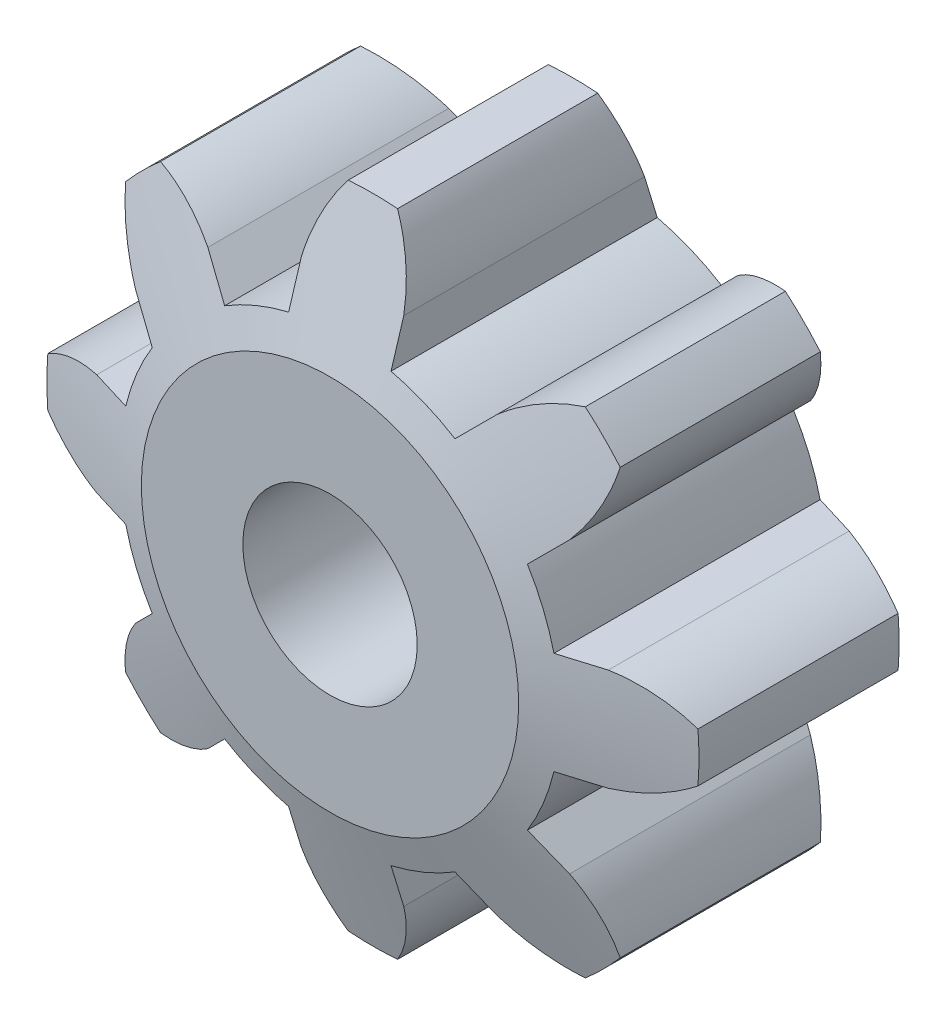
SolidWorks part; units mm, degrees
ref_plane "Front Plane" through (0, 0, 0) normal (0, 0, 1) x (1, 0, 0)
ref_plane "Top Plane" through (0, 0, 0) normal (0, 1, 0) x (1, 0, 0)
ref_plane "Right Plane" through (0, 0, 0) normal (1, 0, 0) x (0, 0, -1)
sketch "Sketch1" plane through (0, 0, 0) normal (1, 0, 0) x (0, 0, -1)
  line L0 (-5, 0) -> (5, 0)
  line L1 (3.5, 11.405) -> (-3.5, 11.405)
  line L14 (-5, 0) -> (-5, 6.6)
  line L15 (-5, 6.6) -> (-3.5, 11.405)
  line L16 (3.5, 11.405) -> (5, 6.6)
  line L17 (5, 6.6) -> (5, 0)
  dimension "D1" = 10
  dimension "D2" = 5
  dimension "D3" = 7
  dimension "D4" = 11.405
  dimension "D7" = 6.6
revolve "Revolve1" add sketch "Sketch1" angle 360 about L0
sketch "Sketch2" plane through (0, 0, 5) normal (0, 0, 1) x (1, 0, 0)
  line L0 (0, 0) -> (0, 11.405) construction
  line L3 (4.029, 6.5618) -> (5.0605, 7.5932)
  line L4 (-1.7909, 7.4888) -> (-1.7909, 8.9475)
  line L5 (1.7909, 8.9475) -> (1.7909, 7.4888)
  line L6 (7.5932, 5.0605) -> (6.5618, 4.029)
  line L8 (7.4888, 1.7909) -> (8.9475, 1.7909)
  line L9 (8.9475, -1.7909) -> (7.4888, -1.7909)
  line L11 (6.5618, -4.029) -> (7.5932, -5.0605)
  line L12 (5.0605, -7.5932) -> (4.029, -6.5618)
  line L14 (1.7909, -7.4888) -> (1.7909, -8.9475)
  line L15 (-1.7909, -8.9475) -> (-1.7909, -7.4888)
  line L17 (-4.029, -6.5618) -> (-5.0605, -7.5932)
  line L18 (-7.5932, -5.0605) -> (-6.5618, -4.029)
  line L20 (-7.4888, -1.7909) -> (-8.9475, -1.7909)
  line L21 (-8.9475, 1.7909) -> (-7.4888, 1.7909)
  line L23 (-6.5618, 4.029) -> (-7.5932, 5.0605)
  line L24 (-5.0605, 7.5932) -> (-4.029, 6.5618)
  circle A0 centre (0, 0) radius 9.125 construction
  circle A1 centre (0, 0) radius 7.7
  circle A2 centre (0, 0) radius 11.405 construction
  arc A5 (-8.6523, 7.4304) -> (-11.3722, 0.864) centre (0, 0) ccw
  arc A6 (-1.7909, 8.9475) -> (-0.84, 11.405) centre (3.1828, 8.4356) cw
  arc A7 (0.84, 11.405) -> (1.7909, 8.9475) centre (-3.1828, 8.4356) cw
  arc A8 (5.0605, 7.5932) -> (7.4706, 8.6585) centre (8.2155, 3.7143) cw
  arc A9 (8.6585, 7.4706) -> (7.5932, 5.0605) centre (3.7143, 8.2155) cw
  arc A10 (8.9475, 1.7909) -> (11.405, 0.84) centre (8.4356, -3.1828) cw
  arc A11 (11.405, -0.84) -> (8.9475, -1.7909) centre (8.4356, 3.1828) cw
  arc A12 (7.5932, -5.0605) -> (8.6585, -7.4706) centre (3.7143, -8.2155) cw
  arc A13 (7.4706, -8.6585) -> (5.0605, -7.5932) centre (8.2155, -3.7143) cw
  arc A14 (1.7909, -8.9475) -> (0.84, -11.405) centre (-3.1828, -8.4356) cw
  arc A15 (-0.84, -11.405) -> (-1.7909, -8.9475) centre (3.1828, -8.4356) cw
  arc A16 (-5.0605, -7.5932) -> (-7.4706, -8.6585) centre (-8.2155, -3.7143) cw
  arc A17 (-8.6585, -7.4706) -> (-7.5932, -5.0605) centre (-3.7143, -8.2155) cw
  arc A18 (-8.9475, -1.7909) -> (-11.405, -0.84) centre (-8.4356, 3.1828) cw
  arc A19 (-11.405, 0.84) -> (-8.9475, 1.7909) centre (-8.4356, -3.1828) cw
  arc A20 (-7.5932, 5.0605) -> (-8.6585, 7.4706) centre (-3.7143, 8.2155) cw
  arc A21 (-7.4706, 8.6585) -> (-5.0605, 7.5932) centre (-8.2155, 3.7143) cw
  arc A22 (-0.864, 11.3722) -> (-7.4304, 8.6523) centre (0, 0) ccw
  arc A23 (7.4304, 8.6523) -> (0.864, 11.3722) centre (0, 0) ccw
  arc A24 (11.3722, 0.864) -> (8.6523, 7.4304) centre (0, 0) ccw
  arc A25 (8.6523, -7.4304) -> (11.3722, -0.864) centre (0, 0) ccw
  arc A26 (0.864, -11.3722) -> (7.4304, -8.6523) centre (0, 0) ccw
  arc A27 (-7.4304, -8.6523) -> (-0.864, -11.3722) centre (0, 0) ccw
  arc A28 (-11.3722, -0.864) -> (-8.6523, -7.4304) centre (0, 0) ccw
  point P17 (1.4803, 10.24)
  point P75 (0, 0)
  dimension "D1" = 18.25
  dimension "D2" = 15.4
  dimension "D7" = 5
  dimension "D8" = 5
  dimension "D3" = 8
  dimension "D5" = 1.68
  dimension "D6" = 0.84
extrude "Cut-Extrude3" cut sketch "Sketch2" against normal through all both and the other way through all contours A6 A22 A21 L24 A1 L4 | A8 A23 A7 L5 A1 L3 | A10 A24 A9 L6 A1 L8 | A12 A25 A11 L9 A1 L11 | A14 A26 A13 L12 A1 L14 | A16 A27 A15 L15 A1 L17 | A18 A28 A17 L18 A1 L20 | L23 A20 A5 A19 L21 A1
sketch "Sketch5" plane through (0, 0, 5) normal (0, 0, 1) x (1, 0, 0)
  circle A0 centre (0, 0) radius 3.05
  dimension "D1" = 6.1
extrude "Cut-Extrude4" cut sketch "Sketch5" against normal through all both and the other way through all
